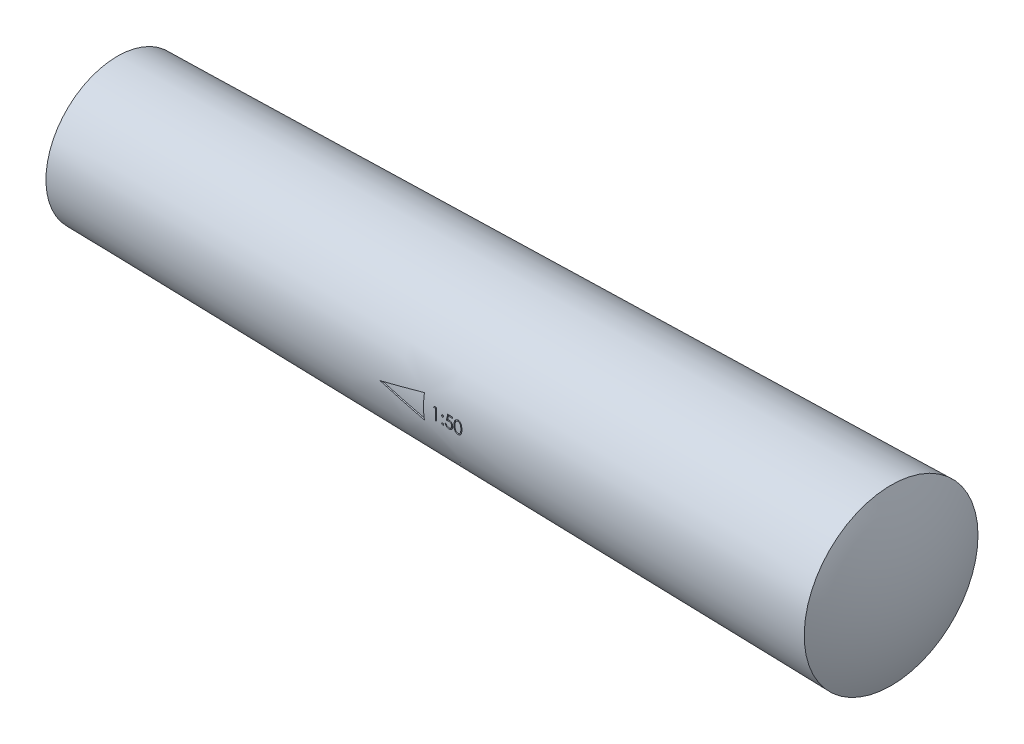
SolidWorks part; units mm, degrees
ref_plane "Front Plane" through (0, 0, 0) normal (0, 0, 1) x (1, 0, 0)
ref_plane "Top Plane" through (0, 0, 0) normal (0, 1, 0) x (1, 0, 0)
ref_plane "Right Plane" through (0, 0, 0) normal (1, 0, 0) x (0, 0, -1)
sketch "Sketch1" plane through (0, 0, 0) normal (1, 0, 0) x (0, 0, -1)
  circle A0 centre (0, 0) radius 6
  dimension "D1" = 12
extrude "Extrude1" add sketch "Sketch1" along normal mid plane 65
draft "Draft1" type of draft neutral plane draft angle 1.146 faces to draft 1 parameters "D1"=1.146
sketch "Sketch2" plane through (0, 0, 0) normal (0, 0, 1) x (1, 0, 0)
  line L0 (-32.5, 0) -> (-32.5, 6)
  line L1 (-32.5, 6) -> (-32.5, -6) construction
  line L2 (-32.5, 0) -> (-34.1, 0)
  line L3 (-34.1, 0) -> (-34.1, -6.65) construction
  line L4 (32.5, 0) -> (32.5, 7.3)
  line L5 (32.5, -7.3) -> (32.5, 7.3) construction
  line L6 (32.5, 0) -> (34.1, 0)
  line L7 (34.1, 0) -> (34.1, -6.65) construction
  line L8 (-32.5, -6) -> (32.5, -7.3) construction
  arc A0 (-34.1, 0) -> (-32.5, 6) centre (-22.05, 0) cw
  arc A1 (34.1, 0) -> (32.5, 7.3) centre (16.6467, 0) ccw
  point P14 (0, -6.65)
revolve "Revolve1" add sketch "Sketch2" angle 360 about L2
sketch "Sketch5" plane through (0, 0, 0) normal (0, 0, 1) x (1, 0, 0)
  line L0 (0, 6.65) -> (0, -6.65) construction
  line L1 (32.5, 7.3) -> (-32.5, 6) construction
  line L2 (-32.5, -6) -> (32.5, -7.3) construction
ref_plane "Plane2" through (0, 0, 0) normal (-0.02, 0, 0.9998) x (0.9998, 0, 0.02)
sketch "Sketch6" plane through (0, 0, 0) normal (-0.02, 0, 0.9998) x (0.9998, 0, 0.02)
  line L0 (0, 0) -> (0, 1)
  line L1 (0, 6.65) -> (0, -6.65) construction
  line L2 (0, 1) -> (-3.7321, 0)
  line L3 (-3.7321, 0) -> (0, -1)
  line L4 (0, -1) -> (0, 0)
  line L5 (0, -0.5) -> (4, -0.5) construction
  text T0 "1:50" font "Century Gothic" height 1
  dimension "D1" = 2
  dimension "D2" = 30
  dimension "D3" = 4
wrap "Wrap2" sketch "Sketch6" wrap type deboss source sketch "Sketch6" thickness 0.1 parameters "D1"=0.1
equation "\"D2@Sketch2\" = \"D1@Sketch2\""
